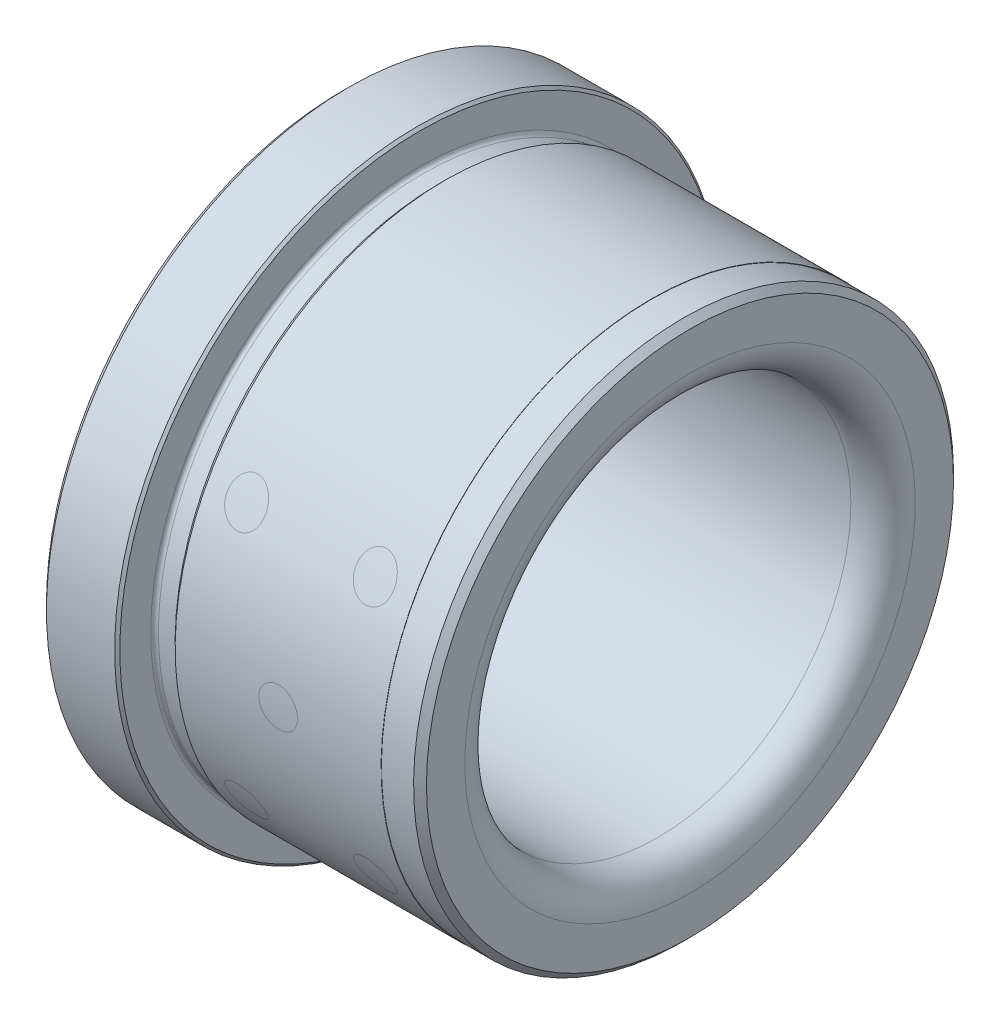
SolidWorks part; units mm, degrees
ref_plane "Front Plane" through (0, 0, 0) normal (0, 0, 1) x (1, 0, 0)
ref_plane "Top Plane" through (0, 0, 0) normal (0, 1, 0) x (1, 0, 0)
ref_plane "Right Plane" through (0, 0, 0) normal (1, 0, 0) x (0, 0, -1)
sketch "Sketch1" plane through (0, 0, 0) normal (0, 0, 1) x (1, 0, 0)
  line L0 (13.5, 20.975) -> (10.5, 20.975)
  line L1 (10.5, 21) -> (-5.5, 21)
  line L2 (10.5, 20.975) -> (10.5, 21)
  line L6 (-7.5, 23.5) -> (-7.5, 20.9)
  line L7 (-7.5, 23.5) -> (-13.5, 23.5)
  line L8 (-13.5, 23.5) -> (-13.5, 0)
  line L13 (13.5, 20.975) -> (13.5, 0)
  line L14 (13.5, 0) -> (-13.5, 0) construction
  line L15 (13.5, 0) -> (-13.5, 0)
  line L16 (-5.5, 21) -> (-5.9, 20.6)
  line L17 (-5.9, 20.6) -> (-7.2, 20.6)
  arc A0 (-7.2, 20.6) -> (-7.5, 20.9) centre (-7.2, 20.9) cw
  point P16 (0, 0)
  dimension "D5" = 0.025
  dimension "D1" = 0.3
  dimension "D2" = 135
  dimension "OD" = 42
  dimension "D3" = 0.4
  dimension "T" = 6
  dimension "HeadDia" = 47
  dimension "S" = 27
  dimension "HeadGap" = 2
  dimension "LeadLength" = 3
revolve "Revolve1" add sketch "Sketch1" angle 360 about L14
sketch "Sketch2" plane through (13.5, 0, 0) normal (1, 0, 0) x (0, 0, -1)
  circle A0 centre (0, 0) radius 15
  circle A1 centre (0, 0) radius 21 construction
  dimension "ID" = 30
extrude "Extrude1" cut sketch "Sketch2" against normal blind 56
sketch "Sketch4" [suppressed] plane through (-48, 0, 0) normal (1, 0, 0) x (0, 0, -1)
  circle A0 centre (0, 0) radius 21.01
  circle A2 centre (0, 0) radius 21 construction
  dimension "D1" = 0.01
extrude "Extrude3" [suppressed] cut sketch "Sketch4" against normal through all
fillet "Fillet2" radius 2.5 1 edges at (13.5, 15, 0)
chamfer "Chamfer5" distance 0.2 angle 45 1 edges at (-7.5, 23.5, 0)
chamfer "Chamfer3" distance 0.5 angle 45 1 edges at (13.5, 20.975, 0)
chamfer "Chamfer4" distance 0.5 angle 45 1 edges at (-13.5, 23.5, 0)
chamfer "Chamfer6" [suppressed] distance 0.5 angle 45
chamfer "Chamfer7" distance 0.5 angle 45 1 edges at (-13.5, -15, 0)
sketch "Sketch5" plane through (0, 0, 0) normal (0, 0, 1) x (1, 0, 0)
  line L0 (-5.5, 0) -> (10.5, 0) construction
  line L1 (-5.5, 21) -> (-5.5, -21) construction
  line L2 (10.5, -21) -> (10.5, 21) construction
  line L3 (2.5, 0) -> (2.5, 11.6457) construction
  circle A0 centre (2.5, 0) radius 1.5 construction
  circle A1 centre (-2.5, 10) radius 1.5
  circle A2 centre (7.5, 10) radius 1.5 construction
  circle A3 centre (-2.5, -10) radius 1.5 construction
  circle A4 centre (7.5, -10) radius 1.5 construction
  dimension "D1" = 3
  dimension "D2" = 5
  dimension "D3" = 10
sketch "Sketch6" plane through (0, 0, 0) normal (0, 0, 1) x (1, 0, 0)
  circle A0 centre (7.5, 10) radius 1.5 construction
  circle A1 centre (7.5, 10) radius 1.5
sketch "Sketch7" plane through (0, 0, 0) normal (0, 0, 1) x (1, 0, 0)
  circle A0 centre (-2.5, -10) radius 1.5 construction
  circle A1 centre (-2.5, -10) radius 1.5
sketch "Sketch8" plane through (0, 0, 0) normal (0, 0, 1) x (1, 0, 0)
  circle A0 centre (7.5, -10) radius 1.5 construction
  circle A1 centre (7.5, -10) radius 1.5
sketch "Sketch10" plane through (0, 0, 0) normal (0, 0, 1) x (1, 0, 0)
  circle A0 centre (2.5, 0) radius 1.5 construction
  circle A1 centre (2.5, 0) radius 1.5
